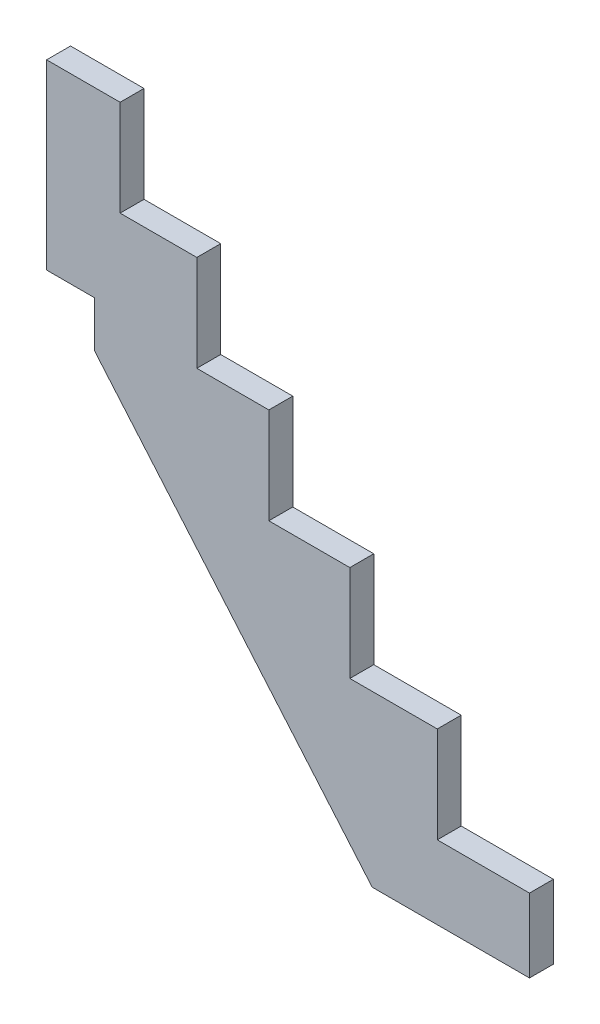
SolidWorks part; units mm, degrees
ref_plane "Спереди" through (0, 0, 0) normal (0, 0, 1) x (1, 0, 0)
ref_plane "Сверху" through (0, 0, 0) normal (0, 1, 0) x (1, 0, 0)
ref_plane "Справа" through (0, 0, 0) normal (1, 0, 0) x (0, 0, -1)
sketch "Эскиз1" plane through (0, 0, 0) normal (0, 0, 1) x (1, 0, 0)
  line L0 (-92.172, -1842.246) -> (-284.8998, -1842.246)
  line L1 (-1001.6327, -1314.9447) -> (-421.0059, -1996.016)
  line L2 (-947.9741, -838.396) -> (-92.172, -1842.246) construction
  line L3 (-284.8998, -1842.246) -> (-284.8998, -1641.476)
  line L4 (-92.172, -1842.246) -> (-92.172, -1996.016)
  line L5 (-1101.6327, -838.396) -> (-1101.6327, -1219.0883)
  line L6 (-1101.6327, -1219.0883) -> (-1001.6327, -1219.0883)
  line L7 (-1001.6327, -1219.0883) -> (-1001.6327, -1314.9447)
  line L8 (-284.8998, -1641.476) -> (-467.7031, -1641.476)
  line L9 (-1001.6327, -1219.0883) -> (-1001.6327, -1996.016) construction
  line L11 (-467.7031, -1641.476) -> (-467.7031, -1440.706)
  line L12 (-467.7031, -1440.706) -> (-637.0482, -1440.706)
  line L15 (-637.0482, -1440.706) -> (-637.0482, -1239.936)
  line L16 (-637.0482, -1239.936) -> (-787.6329, -1239.936)
  line L19 (-787.6329, -1239.936) -> (-787.6329, -1039.166)
  line L20 (-787.6329, -1039.166) -> (-947.9741, -1039.166)
  line L23 (-947.9741, -1039.166) -> (-947.9741, -838.396)
  line L24 (-92.172, -1996.016) -> (-421.0059, -1996.016)
  line L25 (-947.9741, -838.396) -> (-1101.6327, -838.396)
  dimension "D1" = 350
extrude "Вытянуть1" add sketch "Эскиз1" along normal blind 50
sketch3d "Трехмерный эскиз1" plane through (0, 0, 0) normal (0, 0, 1) x (1, 0, 0)
